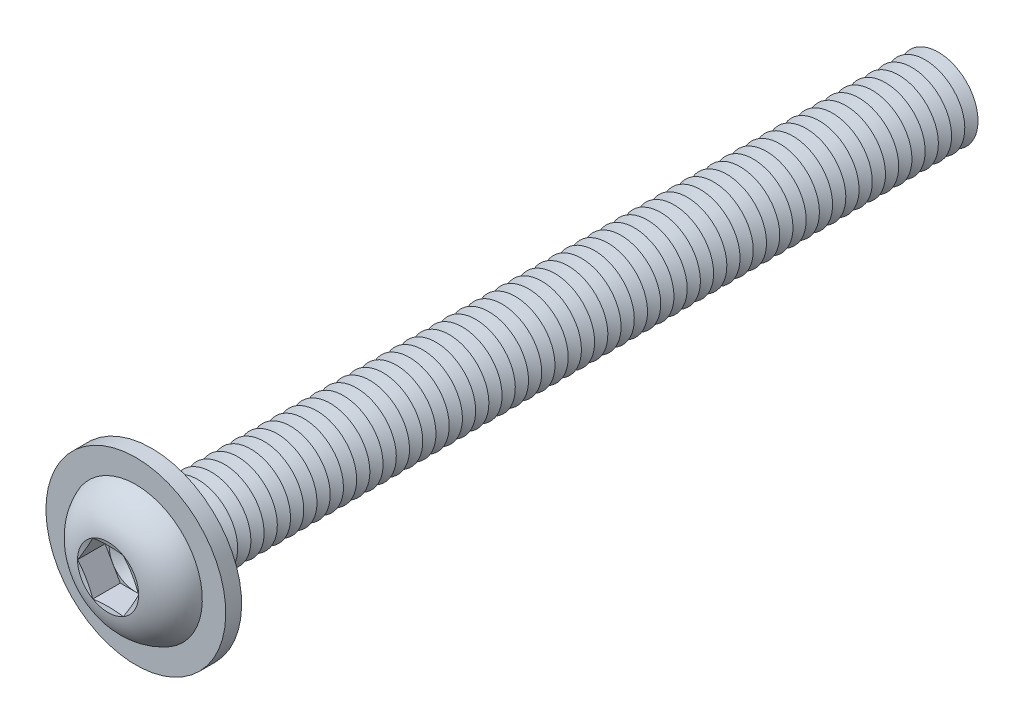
SolidWorks part; units mm, degrees
ref_plane "Front Plane" through (0, 0, 0) normal (0, 0, 1) x (1, 0, 0)
ref_plane "Top Plane" through (0, 0, 0) normal (0, 1, 0) x (1, 0, 0)
ref_plane "Right Plane" through (0, 0, 0) normal (1, 0, 0) x (0, 0, -1)
sketch "Sketch1" plane through (0, 0, 0) normal (1, 0, 0) x (0, 0, -1)
  line L0 (0, 3) -> (0, 5.25)
  line L3 (0, 3) -> (60, 3)
  line L4 (60, 3) -> (60, 0)
  line L5 (60, 0) -> (-3.3, 0) construction
  line L6 (-3.3, 0) -> (60, 0)
  line L7 (-3.3, 2.3094) -> (-3.3, 1.1547) construction
  line L8 (-3.3, 1.1547) -> (-3.3, 0)
  line L9 (-3.3, 2.3094) -> (-2.9906, 1.1547)
  line L10 (-2.9906, 1.1547) -> (-3.3, 1.1547)
  line L11 (60, 0) -> (22.7481, 0) construction
  line L12 (0, 5.25) -> (-3.3, 5.25) construction
  arc A1 (0, 5.25) -> (-3.3, 2.3094) centre (0, 1.928) ccw
  point P8 (60, 1.5)
  dimension "D1" = 10.5
  dimension "D2" = 6
  dimension "D3" = 3.3
  dimension "D4" = 4.6188
  dimension "D5" = 60
  dimension "D6" = 15
revolve "Revolve1" add sketch "Sketch1" angle 360 about L5
fillet "Fillet1" radius 0.5 1 edges at (0, 3, 0)
sketch "Sketch2" plane through (0, 0, 0) normal (1, 0, 0) x (0, 0, -1)
  line L0 (59.5, 3) -> (60.5, 3)
  line L1 (60, 3) -> (0.5, 3) construction
  line L2 (60.5, 3) -> (60, 2.134)
  line L3 (60, -3) -> (60, 3) construction
  line L4 (60, 2.134) -> (59.5, 3)
  dimension "D1" = 1
revolve "Cut-Revolve1" cut sketch "Sketch2" angle 360 about axis through (0, 0, -60) along (0, 0, -1)
pattern_linear "LPattern1" count 60 spacing 1 along (0, 0, 1) of "Cut-Revolve1"
sketch "Sketch3" plane through (0, 0, 3.3) normal (0, 0, 1) x (1, 0, 0)
  line L7 (1.1547, 2) -> (-1.1547, 2)
  line L8 (-1.1547, 2) -> (-2.3094, 0)
  line L9 (-2.3094, 0) -> (-1.1547, -2)
  line L10 (-1.1547, -2) -> (1.1547, -2)
  line L11 (1.1547, -2) -> (2.3094, 0)
  line L12 (2.3094, 0) -> (1.1547, 2)
  circle A0 centre (0, 0) radius 2 construction
  circle A3 centre (0, 0) radius 2.3094 construction
extrude "Cut-Extrude1" cut sketch "Sketch3" against normal blind 2.08
sketch "Sketch4" plane through (0, 0, 1.22) normal (0, 0, 1) x (1, 0, 0)
  line L1 (1.1547, 2) -> (-1.1547, 2) construction
  circle A0 centre (0, 0) radius 2
extrude "Cut-Extrude2" cut sketch "Sketch4" against normal through all draft 60
sketch "Sketch5" plane through (0, 0, 0) normal (0, 0, -1) x (-1, 0, 0)
  circle A0 centre (0, 0) radius 6.8
  circle A1 centre (0, 0) radius 3.5
  circle A2 centre (0, 0) radius 3.5 construction
  dimension "D1" = 13.6
extrude "Boss-Extrude1" add sketch "Sketch5" against normal blind 1.2
